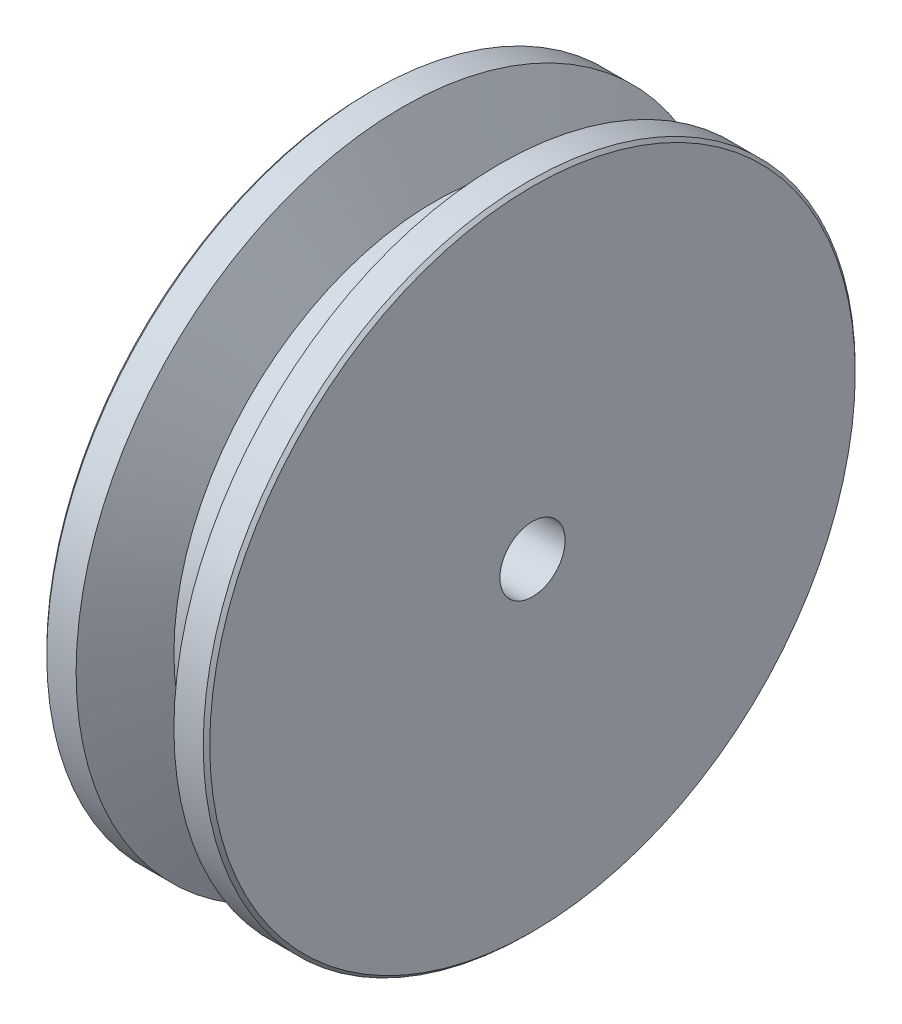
SolidWorks part; units mm, degrees
ref_plane "正面" through (0, 0, 0) normal (0, 0, 1) x (1, 0, 0)
ref_plane "平面" through (0, 0, 0) normal (0, 1, 0) x (1, 0, 0)
ref_plane "右側面" through (0, 0, 0) normal (1, 0, 0) x (0, 0, -1)
sketch "ｽｹｯﾁ1" plane through (0, 0, 0) normal (0, 0, 1) x (1, 0, 0)
  line L0 (0, 100) -> (0, 40)
  line L1 (0, 40) -> (-30, 40)
  line L2 (-30, 40) -> (-30, 10)
  line L3 (-30, 10) -> (50, 10)
  line L4 (50, 10) -> (50, 100)
  line L5 (50, 100) -> (40, 100)
  line L6 (40, 100) -> (30, 80)
  line L7 (30, 80) -> (20, 80)
  line L8 (20, 80) -> (10, 100)
  line L9 (10, 100) -> (0, 100)
  line L10 (-74.0743, 0) -> (86.5683, 0) construction
  dimension "D1" = 80
  dimension "D2" = 30
  dimension "D3" = 40
  dimension "D4" = 10
  dimension "D5" = 100
  dimension "D6" = 20
  dimension "D7" = 20
  dimension "D8" = 10
  dimension "D9" = 10
  dimension "D10" = 20
revolve "回転1" add sketch "ｽｹｯﾁ1" angle 360 about L10
chamfer "面取り1" distance 1 angle 45 2 edges at (0, 0, 100) (50, 0, 100)
chamfer "面取り2" distance 5 angle 45 1 edges at (-30, 0, 40)
